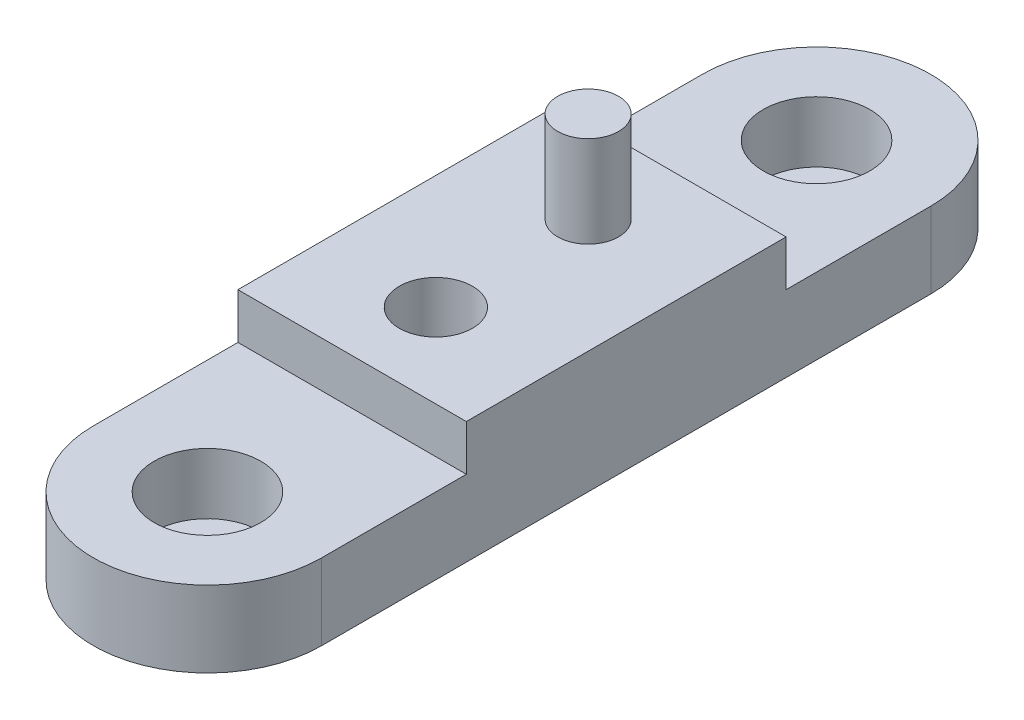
SolidWorks part; units mm, degrees
ref_plane "Front" through (0, 0, 0) normal (0, 0, 1) x (1, 0, 0)
ref_plane "Top" through (0, 0, 0) normal (0, 1, 0) x (1, 0, 0)
ref_plane "Right" through (0, 0, 0) normal (1, 0, 0) x (0, 0, -1)
sketch "Sketch1" plane through (0, 0, 0) normal (0, 1, 0) x (1, 0, 0)
  line L0 (0, 1.75) -> (-8.1896, 1.75) construction
  line L1 (0, 3.75) -> (-8.1896, 3.75) construction
  line L2 (-3.75, -10) -> (3.75, -10)
  line L3 (-3.75, 0) -> (3.75, 0) construction
  line L4 (-3.75, 0) -> (-3.75, -10)
  line L6 (3.75, 0) -> (3.75, -10)
  circle A0 centre (0, 0) radius 1.75 construction
  arc A1 (3.75, 0) -> (-3.75, 0) centre (0, 0) ccw
  dimension "D1" = 3.5
  dimension "D2" = 2
  dimension "D3" = 10
extrude "Boss-Extrude1" add sketch "Sketch1" along normal blind 4
sketch "Sketch2" plane through (0, 4, 0) normal (0, 1, 0) x (1, 0, 0)
  line L0 (0, 0) -> (-11.0692, 0) construction
  line L1 (-3.75, -4.75) -> (3.75, -4.75)
  line L2 (-3.75, 0) -> (-3.75, -10) construction
  line L3 (3.75, -10) -> (3.75, 0) construction
  line L4 (-3.75, 0) -> (-3.75, -4.75)
  line L5 (3.75, 0) -> (3.75, -4.75)
  line L6 (0, -3.75) -> (-8.4344, -3.75) construction
  arc A0 (3.75, 0) -> (-3.75, 0) centre (0, 0) ccw construction
  arc A1 (3.75, 0) -> (-3.75, 0) centre (0, 0) ccw
  circle A2 centre (0, 0) radius 3.75 construction
  dimension "D1" = 1
extrude "Cut-Extrude1" cut sketch "Sketch2" against normal blind 1.5
sketch "Sketch3" plane through (0, 2.5, 0) normal (0, 1, 0) x (1, 0, 0)
  circle A0 centre (0, 0) radius 1.75
  dimension "D1" = 3.5
extrude "Cut-Extrude2" cut sketch "Sketch3" against normal blind 2
mirror "Mirror1" about plane through (-3.75, 4, 10) normal (0, 0, -1)
sketch "Sketch4" plane through (0, 4, 0) normal (0, 1, 0) x (1, 0, 0)
  line L0 (0, -4.75) -> (0, -15.25) construction
  line L1 (-3.75, -4.75) -> (3.75, -4.75) construction
  line L2 (-3.75, -15.25) -> (3.75, -15.25) construction
  line L3 (0, -10) -> (-6.044, -10) construction
  circle A0 centre (0, -7.5) radius 1
  dimension "D2" = 2
  dimension "D1" = 2.5
extrude "Boss-Extrude2" add sketch "Sketch4" along normal blind 3
sketch "Sketch5" plane through (0, 4, 0) normal (0, 1, 0) x (1, 0, 0)
  line L0 (0, -4.75) -> (0, -15.25) construction
  line L1 (-3.75, -4.75) -> (3.75, -4.75) construction
  line L2 (-3.75, -15.25) -> (3.75, -15.25) construction
  line L3 (0, -10) -> (-7.1463, -10) construction
  circle A0 centre (0, -12.5) radius 1.2
  dimension "D2" = 2.4
  dimension "D1" = 2.5
extrude "Cut-Extrude3" cut sketch "Sketch5" against normal blind 4
